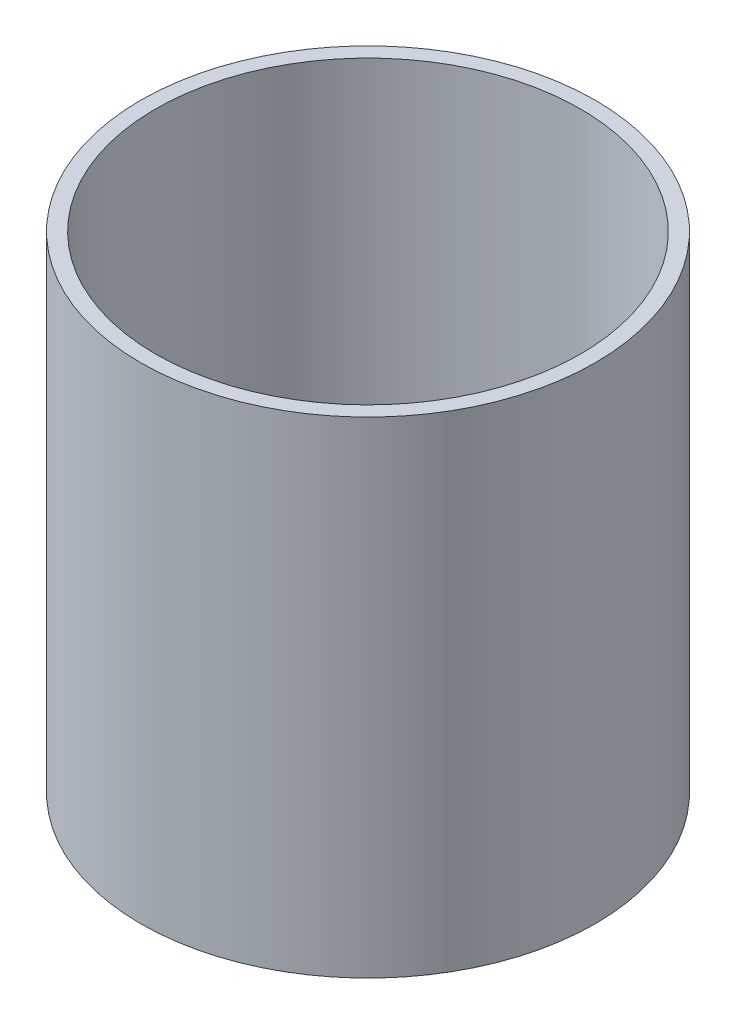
SolidWorks part; units mm, degrees
ref_plane "Front Plane" through (0, 0, 0) normal (0, 0, 1) x (1, 0, 0)
ref_plane "Top Plane" through (0, 0, 0) normal (0, 1, 0) x (1, 0, 0)
ref_plane "Right Plane" through (0, 0, 0) normal (1, 0, 0) x (0, 0, -1)
sketch "Sketch1" plane through (0, 0, 0) normal (0, 1, 0) x (1, 0, 0)
  circle A0 centre (0, 0) radius 77.724
  circle A1 centre (0, 0) radius 83.185
extrude "Boss-Extrude1" add sketch "Sketch1" along normal blind 177.8
